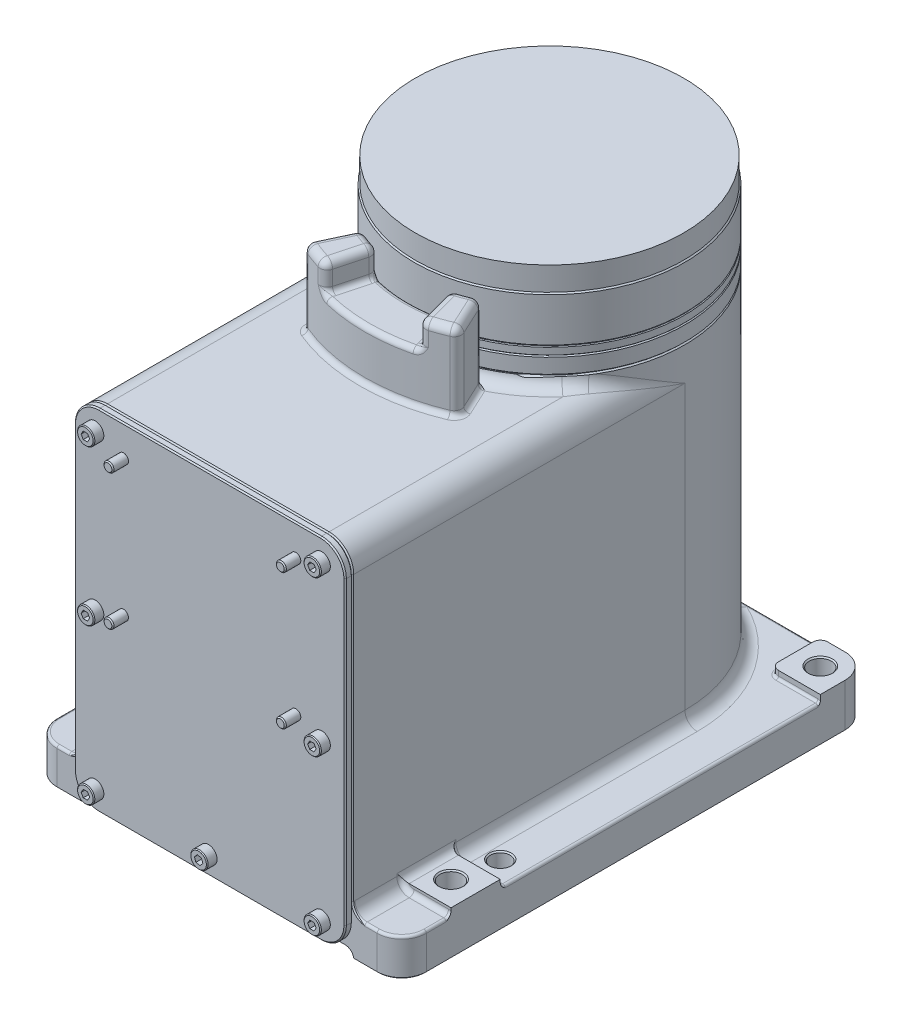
SolidWorks part; units mm, degrees
other "凸台-拉伸2"
ref_plane "前视基准面" through (0, 0, 0) normal (0, 0, 1) x (1, 0, 0)
ref_plane "上视基准面" through (0, 0, 0) normal (0, 1, 0) x (1, 0, 0)
ref_plane "右视基准面" through (0, 0, 0) normal (1, 0, 0) x (0, 0, -1)
imported_body "输入1"
other "移动面1" parameters "D1"=2.4
